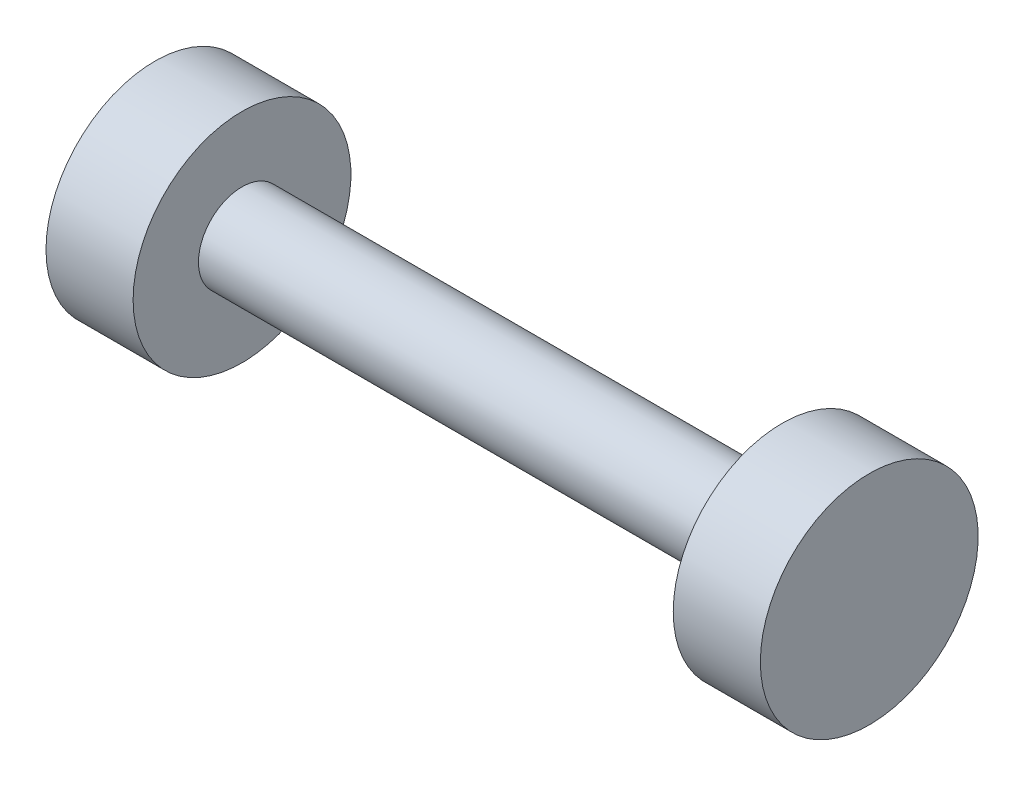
SolidWorks part; units mm, degrees
ref_plane "Frontal" through (0, 0, 0) normal (0, 0, 1) x (1, 0, 0)
ref_plane "Horizontal" through (0, 0, 0) normal (0, 1, 0) x (1, 0, 0)
ref_plane "Vertical" through (0, 0, 0) normal (1, 0, 0) x (0, 0, -1)
sketch "Esquisse1" plane through (0, 0, 0) normal (0, 0, 1) x (1, 0, 0)
  line L0 (-8.2, 0) -> (-8.2, 2.5)
  line L1 (-8.2, 2.5) -> (-6.2, 2.5)
  line L2 (-6.2, 2.5) -> (-6.2, 1)
  line L3 (-6.2, 1) -> (6.2, 1)
  line L4 (6.2, 1) -> (6.2, 2.5)
  line L5 (6.2, 2.5) -> (8.2, 2.5)
  line L6 (8.2, 2.5) -> (8.2, 0)
  line L7 (8.2, 0) -> (-8.2, 0)
  line L8 (-31.6193, 0) -> (29.701, 0) construction
  line L9 (0, 0) -> (0, 16.6264) construction
  dimension "D1" = 2
  dimension "D2" = 2
  dimension "D3" = 2
  dimension "D4" = 12.4
  dimension "D5" = 5
revolve "Base-Révolution" add sketch "Esquisse1" angle 360 about L8
